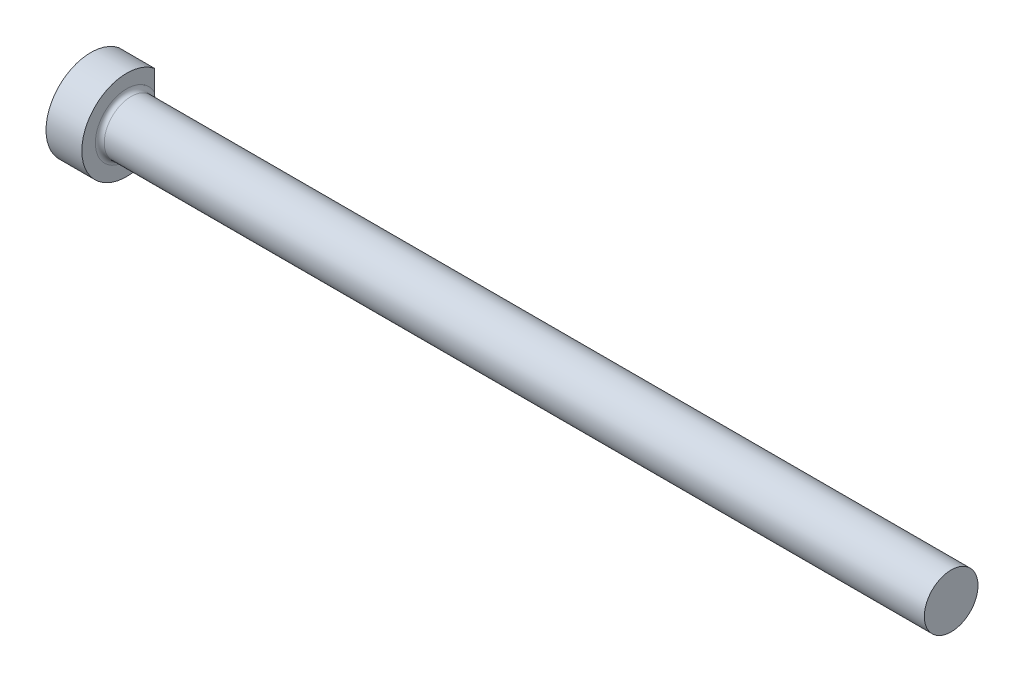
SolidWorks part; units mm, degrees
ref_plane "Front Plane" through (0, 0, 0) normal (0, 0, 1) x (1, 0, 0)
ref_plane "Top Plane" through (0, 0, 0) normal (0, 1, 0) x (1, 0, 0)
ref_plane "Right Plane" through (0, 0, 0) normal (1, 0, 0) x (0, 0, -1)
sketch "Sketch1" plane through (0, 0, 0) normal (0, 0, 1) x (1, 0, 0)
  line L0 (0, 0) -> (0, 7.9375)
  line L1 (0, 7.9375) -> (6.35, 7.9375)
  line L2 (6.35, 7.9375) -> (6.35, 5.5435)
  line L3 (7.1374, 4.7561) -> (152.4, 4.7561)
  line L4 (152.4, 4.7561) -> (152.4, 0)
  line L5 (152.4, 0) -> (0, 0)
  line L6 (152.4, 0) -> (0, 0) construction
  line L7 (0, 0) -> (-10.4771, 0) construction
  line L8 (152.4, 0) -> (1002.3976, 0) construction
  line L9 (7.1374, 4.7561) -> (-7.9138, 4.7561) construction
  arc A0 (7.1374, 4.7561) -> (6.35, 5.5435) centre (7.1374, 5.5435) cw
  dimension "D1" = 0.7874
  dimension "HeadDia" = 15.875
  dimension "HeadThickness" = 6.35
  dimension "PinDia" = 9.5123
  dimension "overall" = 152.4
revolve "PIN" add sketch "Sketch1" angle 360 about L6
ref_plane "Plane1" through (79.7687, 0, -4.7562) normal (0, 0, -1) x (0, -1, 0)
ref_plane "CutPlane" through (0, 0, -4.934) normal (0, 0, -1) x (-1, 0, 0)
other "SurfaceCut1"
